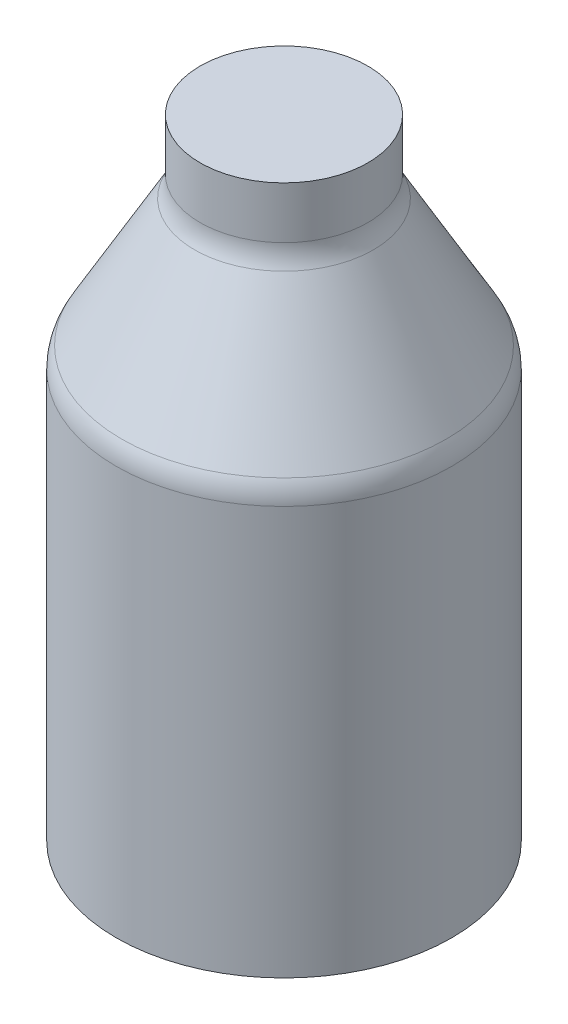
SolidWorks part; units mm, degrees
ref_plane "Plan de face" through (0, 0, 0) normal (0, 0, 1) x (1, 0, 0)
ref_plane "Plan de dessus" through (0, 0, 0) normal (0, 1, 0) x (1, 0, 0)
ref_plane "Plan de droite" through (0, 0, 0) normal (1, 0, 0) x (0, 0, -1)
sketch "Esquisse1" plane through (0, 0, 0) normal (0, 0, 1) x (1, 0, 0)
  line L0 (0, 0) -> (-40, 0)
  line L1 (0, 0) -> (-40, 0) construction
  line L2 (0, 0) -> (0, 150) construction
  line L3 (0, 150) -> (-40, 150) construction
  line L4 (-40, 0) -> (-40, 150) construction
  line L5 (-40, 0) -> (-40, 100)
  line L6 (-40, 100) -> (-20, 135)
  line L7 (-20, 135) -> (-20, 150)
  line L8 (-20, 150) -> (0, 150)
  line L9 (0, 150) -> (0, 0)
  dimension "D1" = 40
  dimension "D2" = 150
  dimension "D3" = 100
  dimension "D4" = 35
  dimension "D5" = 20
revolve "Révolution1" add sketch "Esquisse1" angle 360 about L9
fillet "Congé1" radius 10 2 edges at (-20, 135, 0) (-40, 100, 0)
